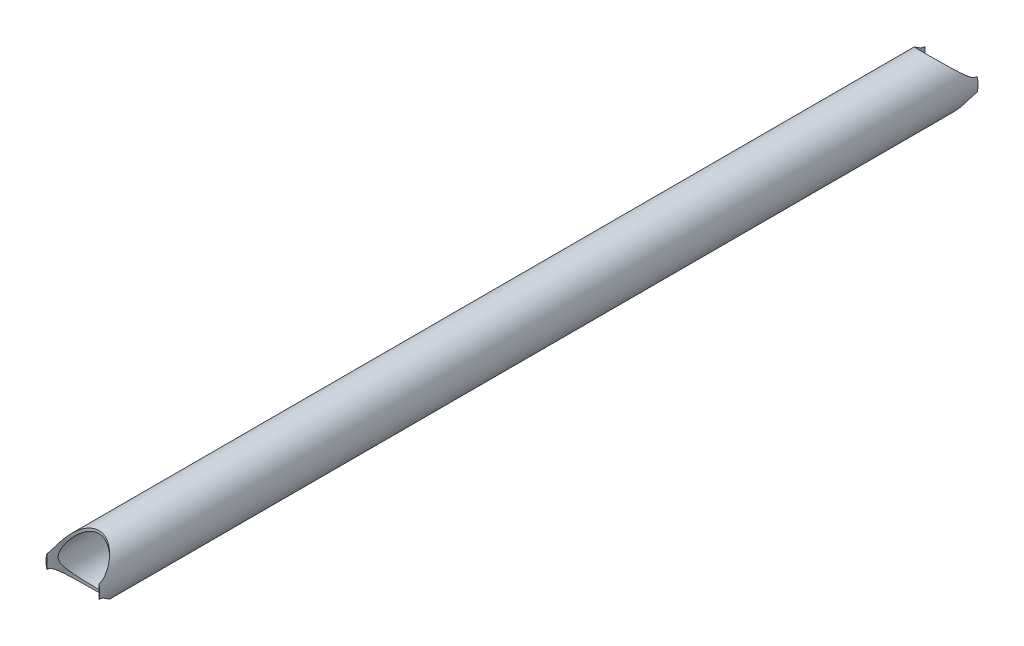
SolidWorks part; units mm, degrees
ref_plane "Plan de face" through (0, 0, 0) normal (0, 0, 1) x (1, 0, 0)
ref_plane "Plan de dessus" through (0, 0, 0) normal (0, 1, 0) x (1, 0, 0)
ref_plane "Plan de droite" through (0, 0, 0) normal (1, 0, 0) x (0, 0, -1)
sketch "Esquisse2" plane through (0, 0, 0) normal (0, 0, 1) x (1, 0, 0)
  circle A0 centre (0, 0) radius 15
  circle A1 centre (0, 0) radius 13.5
  dimension "D1" = 30
  dimension "D2" = 27
extrude "Extrusion1" add sketch "Esquisse2" along normal blind 490
ref_plane "Plan1" through (0, 0, 0) normal (0, 1, 0) x (-1, 0, 0)
sketch "Esquisse3" plane through (0, 0, 0) normal (0, 1, 0) x (-1, 0, 0)
  line L0 (15, 490) -> (-15, 490) construction
  line L1 (0, 513.0929) -> (0, 461.3844) construction
  line L2 (15, 0) -> (15, 490) construction
  line L3 (-15, 490) -> (-15, 0) construction
  line L4 (0, 16.9585) -> (0, -6.9448) construction
  circle A0 centre (0, 490) radius 14.5
  circle A1 centre (0, 0) radius 14.5
  dimension "D1" = 29
  dimension "D2" = 29
extrude "Extrusion2" cut sketch "Esquisse3" against normal through all and the other way through all
